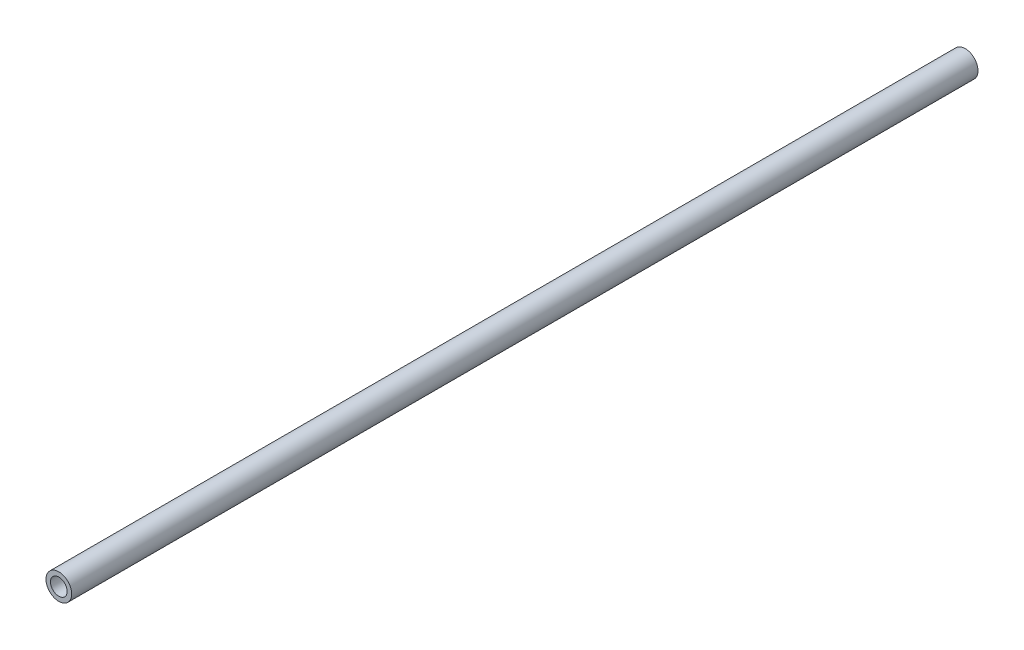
SolidWorks part; units mm, degrees
ref_plane "Face" through (0, 0, 0) normal (0, 0, 1) x (1, 0, 0)
ref_plane "Dessus" through (0, 0, 0) normal (0, 1, 0) x (1, 0, 0)
ref_plane "Droite" through (0, 0, 0) normal (1, 0, 0) x (0, 0, -1)
sketch "Esquisse1" plane through (0, 0, 0) normal (0, 0, 1) x (1, 0, 0)
  circle A0 centre (0, 0) radius 0.65
  circle A1 centre (0, 0) radius 1
  dimension "D1" = 1.3
  dimension "D2" = 2
extrude "Extrusion1" add sketch "Esquisse1" along normal blind 70.6
